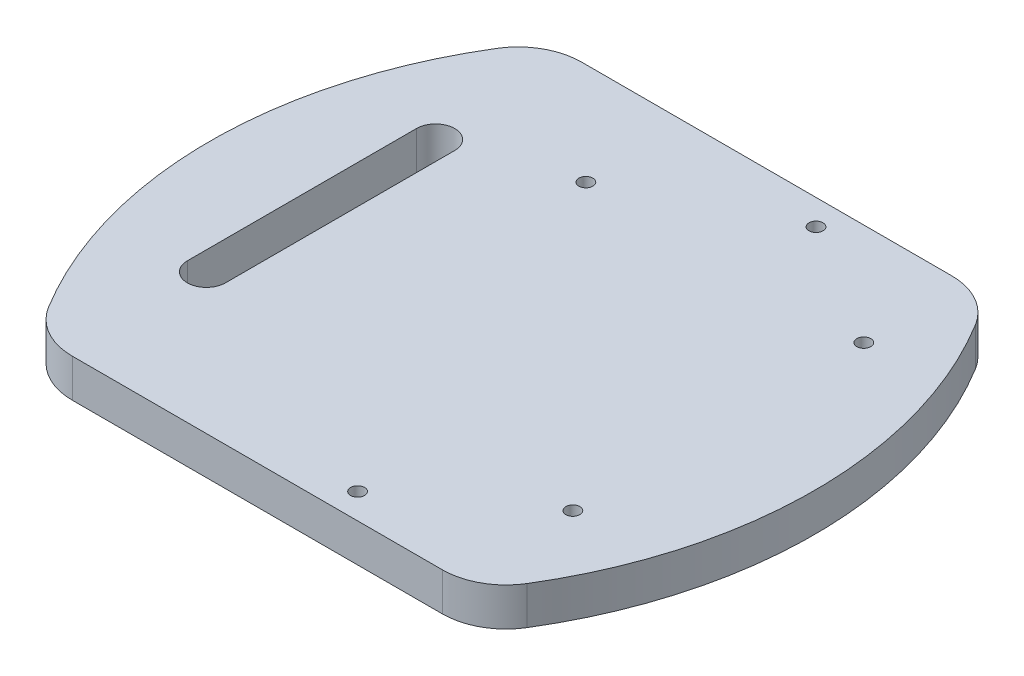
SolidWorks part; units mm, degrees
ref_plane "Plan de face" through (0, 0, 0) normal (0, 0, 1) x (1, 0, 0)
ref_plane "Plan de dessus" through (0, 0, 0) normal (0, 1, 0) x (1, 0, 0)
ref_plane "Plan de droite" through (0, 0, 0) normal (1, 0, 0) x (0, 0, -1)
sketch "Esquisse1" plane through (0, 0, 0) normal (0, 1, 0) x (1, 0, 0)
  line L0 (-111.0793, 0) -> (144.6389, 0) construction
  line L1 (0, -103.2463) -> (0, 92.4278) construction
  line L2 (-35, 40) -> (78.1596, 40) construction
  line L3 (5.6, 47) -> (5.6, 29.4615) construction
  line L4 (6.75, 42.1123) -> (6.75, 8.5) construction
  line L5 (36.9653, 36) -> (2.8283, 36) construction
  line L6 (34.3052, 20) -> (65, 20) construction
  line L7 (29, 54.1791) -> (29, -44.9752) construction
  line L8 (-34.0535, 40) -> (24.0535, 40)
  line L9 (-34.0535, -40) -> (24.0535, -40)
  line L10 (-39.7987, 16) -> (58.2616, 16) construction
  line L11 (-46.2908, 32) -> (36.9653, 32) construction
  line L12 (-38, 44.6634) -> (-38, -34.2446) construction
  line L16 (-35, 25.2191) -> (-35, -14.3295) construction
  line L17 (-64.3052, -63) -> (-26, -63) construction
  line L18 (26, -63) -> (34.3052, -63) construction
  line L19 (-26, -63) -> (-26, -47) construction
  line L20 (26, -63) -> (26, -47) construction
  line L21 (-22, -43) -> (22, -43) construction
  line L22 (26, 63) -> (34.3052, 63) construction
  line L23 (26, 63) -> (26, 47) construction
  line L24 (-22, 43) -> (22, 43) construction
  line L25 (-26, 63) -> (-26, 47) construction
  line L26 (-64.3052, 63) -> (-26, 63) construction
  line L27 (-38, 18) -> (-38, -18)
  line L28 (-32, 18) -> (-32, -18)
  line L29 (19, 36.0508) -> (19, -36) construction
  line L30 (22.8, 26.8888) -> (22.8, -60.7912) construction
  line L31 (28.9411, 24.2) -> (-65.8756, 24.2) construction
  line L32 (-65.8756, -24.2) -> (28.9411, -24.2) construction
  arc A0 (34.3052, -63) -> (34.3052, 63) centre (-15, 0) ccw construction
  arc A1 (-42.5846, -35.2174) -> (-34.0535, -40) centre (-34.0535, -30) ccw
  arc A2 (-42.5846, -35.2174) -> (-42.5846, 35.2174) centre (15, 0) cw
  arc A3 (-34.0535, 40) -> (-42.5846, 35.2174) centre (-34.0535, 30) ccw
  circle A4 centre (26.26, 24) radius 1.1
  circle A5 centre (-17.4, 24) radius 1.1
  circle A6 centre (26.26, -21.7) radius 1.1
  arc A9 (26, 47) -> (22, 43) centre (22, 47) cw construction
  arc A10 (-64.3052, 63) -> (-64.3052, -63) centre (-15, 0) ccw construction
  arc A11 (-22, 43) -> (-26, 47) centre (-22, 47) cw construction
  arc A12 (22, -43) -> (26, -47) centre (22, -47) cw construction
  arc A13 (-26, -47) -> (-22, -43) centre (-22, -47) cw construction
  circle A14 centre (-35, -8.5) radius 1.1 construction
  circle A15 centre (-29, 4) radius 2.5 construction
  circle A16 centre (-71, -31.5) radius 1.1 construction
  circle A17 centre (-71, 31.5) radius 1.1 construction
  circle A18 centre (-80, 0) radius 1.1 construction
  circle A19 centre (-35, 8.5) radius 1.1 construction
  circle A20 centre (-35, 0) radius 3.25 construction
  circle A21 centre (-29, -4) radius 2.5 construction
  circle A22 centre (-80, 0) radius 9 construction
  circle A23 centre (6.75, 36) radius 1.1
  circle A25 centre (6.75, -36) radius 1.1
  arc A28 (-32, -18) -> (-38, -18) centre (-35, -18) cw
  arc A29 (-32, 18) -> (-38, 18) centre (-35, 18) ccw
  arc A31 (32.5846, -35.2174) -> (24.0535, -40) centre (24.0535, -30) cw
  arc A33 (32.5846, -35.2174) -> (32.5846, 35.2174) centre (-25, 0) ccw
  arc A35 (24.0535, 40) -> (32.5846, 35.2174) centre (24.0535, 30) cw
  point P31 (0, -40)
  point P37 (0, 40)
  dimension "D9" = 38
  dimension "D13" = 3
  dimension "D16" = 48.4
  dimension "D4" = 22.25
  dimension "D7" = 16
  dimension "D1" = 40
  dimension "D2" = 1.15
  dimension "D3" = 20
  dimension "D5" = 57
  dimension "D6" = 32
  dimension "D14" = 57.8
  dimension "D15" = 24.2
extrude "Extrusion1" add sketch "Esquisse1" along normal blind 6
